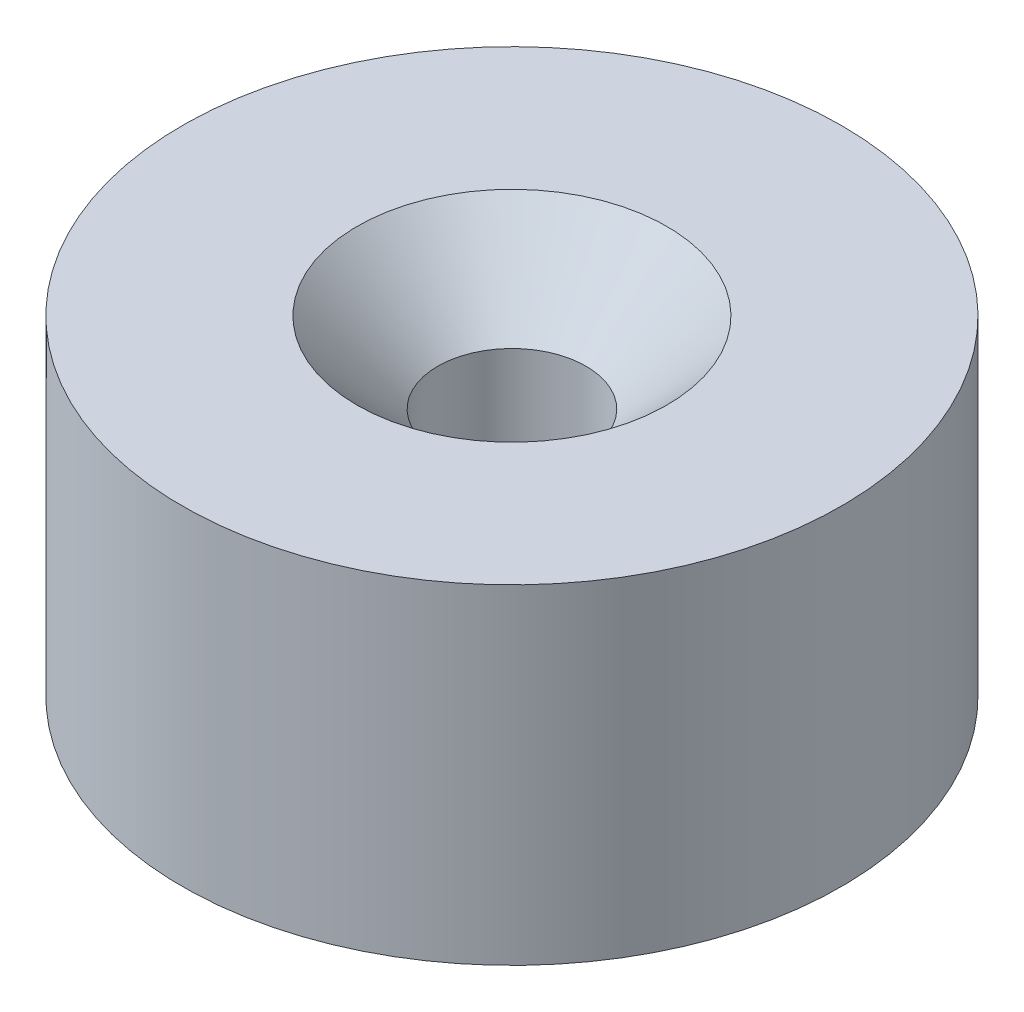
SolidWorks part; units mm, degrees
ref_plane "Front Plane" through (0, 0, 0) normal (0, 0, 1) x (1, 0, 0)
ref_plane "Top Plane" through (0, 0, 0) normal (0, 1, 0) x (1, 0, 0)
ref_plane "Right Plane" through (0, 0, 0) normal (1, 0, 0) x (0, 0, -1)
sketch "Sketch1" plane through (0, 0, 0) normal (1, 0, 0) x (0, 0, -1)
  line L0 (0, 0) -> (0, 14.5)
  line L1 (0, 14.5) -> (10, 14.5)
  line L2 (10, 14.5) -> (10, 4.5)
  line L3 (10, 4.5) -> (3, 4.5)
  line L4 (3, 4.5) -> (3, 0)
  line L5 (3, 0) -> (0, 0)
  dimension "D1" = 10
  dimension "D2" = 3
  dimension "D3" = 10
  dimension "D4" = 14.5
revolve "Revolve1" add sketch "Sketch1" angle 360 about L0
hole_wizard "CSK for M4 Countersunk Flat Head Screw1" positions "3DSketch1" profile "Sketch3" countersink size "M4" standard "ISO"
sketch3d "3DSketch1"
  line L0 (0, 14.5, 0) -> (0, 4.5, 0) construction
  point P0 (0, 14.5, 0)
sketch "Sketch3" plane through (0, 14.5, 0) normal (1, 0, 0) x (0, 0, 1)
  line L0 (0, 0) -> (0, 14.5)
  line L1 (0, 14.5) -> (2.25, 14.5)
  line L2 (2.25, 14.5) -> (2.25, 2.45)
  line L3 (2.25, 2.45) -> (4.7, 0)
  line L5 (4.7, 0) -> (0, 0)
  line L6 (-2.25, 2.45) -> (-4.7, 0) construction
  line L11 (0, -6.35) -> (0, 107.95) construction
  dimension "Thru Hole Dia." = 4.5
  dimension "Thru Hole Depth" = 14.5
  dimension "Near C'Sink Dia." = 9.4
  dimension "Near C'Sink Angle" = 90
